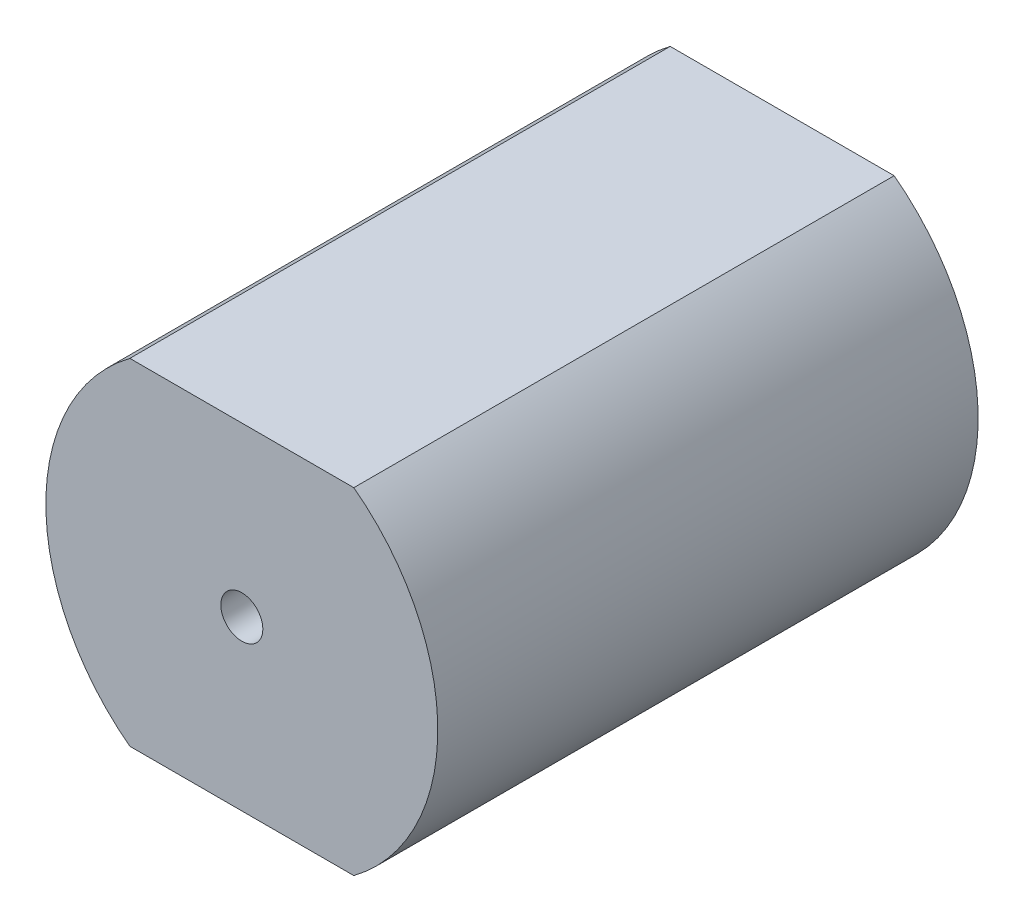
SolidWorks part; units mm, degrees
ref_plane "Plan de face" through (0, 0, 0) normal (0, 0, 1) x (1, 0, 0)
ref_plane "Plan de dessus" through (0, 0, 0) normal (0, 1, 0) x (1, 0, 0)
ref_plane "Plan de droite" through (0, 0, 0) normal (1, 0, 0) x (0, 0, -1)
sketch "Esquisse1" plane through (0, 0, 0) normal (0, 0, 1) x (1, 0, 0)
  line L0 (9.8347, 0) -> (-8.3467, 0) construction
  line L1 (4, 6) -> (-4, 6)
  line L2 (4, 6) -> (4, -6) construction
  line L3 (4, -6) -> (-4, -6)
  line L4 (-4, 6) -> (-4, -6) construction
  line L5 (7, 0) -> (-7, 0) construction
  arc A0 (-4, 6) -> (-4, -6) centre (0.5, 0) ccw
  arc A1 (4, 6) -> (4, -6) centre (-0.5, 0) cw
  dimension "D3" = 4
  dimension "D5" = 7.5
  dimension "D6" = 7.5
  dimension "D4" = 12
  dimension "D1" = 8
  dimension "D2" = 6
  dimension "D7" = 14
extrude "Boss.-Extru.1" add sketch "Esquisse1" along normal blind 19.3
sketch "Esquisse2" plane through (0, 0, 19.3) normal (0, 0, 1) x (1, 0, 0)
  circle A0 centre (0, 0) radius 0.75
extrude "Enlèv. mat.-Extru.1" cut sketch "Esquisse2" against normal blind 2
